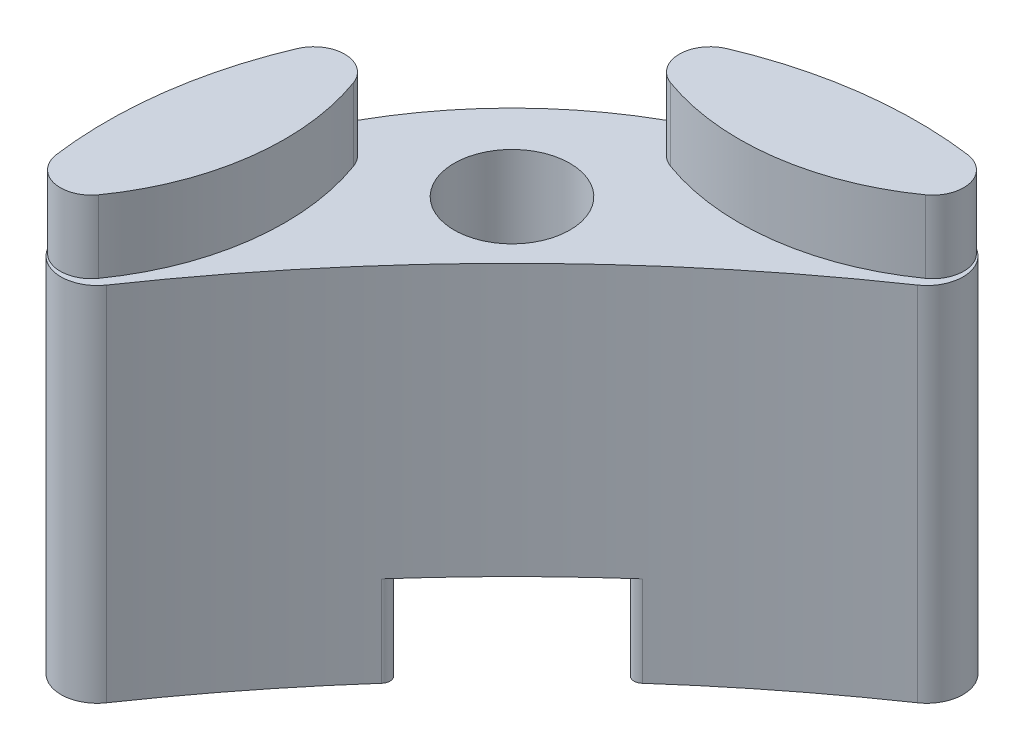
SolidWorks part; units mm, degrees
ref_plane "前视基准面" through (0, 0, 0) normal (0, 0, 1) x (1, 0, 0)
ref_plane "上视基准面" through (0, 0, 0) normal (0, 1, 0) x (1, 0, 0)
ref_plane "右视基准面" through (0, 0, 0) normal (1, 0, 0) x (0, 0, -1)
other "Configuration Table"
sketch "草图1" plane through (0, 0, 0) normal (0, 1, 0) x (1, 0, 0)
  line L0 (-32, 32) -> (32, 32) construction
  line L1 (-32, 32) -> (-32, -32) construction
  circle A0 centre (0, 0) radius 40 construction
  circle A3 centre (-32, 32) radius 1.6
  arc A4 (-34.7793, 30.8707) -> (-30.8707, 34.7793) centre (-32, 32) cw
  arc A5 (-30.8707, 34.7793) -> (-24.2826, 35.4874) centre (-28.2356, 41.2644) ccw
  arc A6 (-24.2826, 35.4874) -> (24.2826, 35.4874) centre (0, 0) cw
  arc A7 (-34.7793, 30.8707) -> (-35.4874, 24.2826) centre (-41.2644, 28.2356) cw
  arc A8 (30.8707, 34.7793) -> (34.7793, 30.8707) centre (32, 32) cw
  arc A9 (30.8707, 34.7793) -> (24.2826, 35.4874) centre (28.2356, 41.2644) cw
  arc A10 (34.7793, 30.8707) -> (35.4874, 24.2826) centre (41.2644, 28.2356) ccw
  arc A11 (35.4874, 24.2826) -> (35.4874, -24.2826) centre (0, 0) cw
  arc A12 (34.7793, -30.8707) -> (30.8707, -34.7793) centre (32, -32) cw
  arc A13 (34.7793, -30.8707) -> (35.4874, -24.2826) centre (41.2644, -28.2356) cw
  arc A14 (30.8707, -34.7793) -> (24.2826, -35.4874) centre (28.2356, -41.2644) ccw
  arc A15 (24.2826, -35.4874) -> (-24.2826, -35.4874) centre (0, 0) cw
  arc A16 (-30.8707, -34.7793) -> (-34.7793, -30.8707) centre (-32, -32) cw
  arc A17 (-30.8707, -34.7793) -> (-24.2826, -35.4874) centre (-28.2356, -41.2644) cw
  arc A18 (-34.7793, -30.8707) -> (-35.4874, -24.2826) centre (-41.2644, -28.2356) ccw
  arc A19 (-35.4874, -24.2826) -> (-35.4874, 24.2826) centre (0, 0) cw
  circle A20 centre (32, 32) radius 1.6
  circle A21 centre (32, -32) radius 1.6
  circle A22 centre (-32, -32) radius 1.6
  point P41 (0, 0)
  dimension "D2" = 80
  dimension "D3" = 4
  dimension "D4" = 3.2
  dimension "D7" = 43
  dimension "D8" = 7
  dimension "D9" = 3
  dimension "D5" = 32
  dimension "D6" = 32
  dimension "D12" = 90
  dimension "D13" = 64
  dimension "D14" = 64
  dimension "D10" = 2
  dimension "D11" = 2
extrude "凸台-拉伸1" add sketch "草图1" along normal blind 3
sketch "草图2" plane through (0, 0, 0) normal (0, -1, 0) x (1, 0, 0)
  circle A0 centre (-32, -32) radius 1.6
  arc A2 (-35.4874, -24.2826) -> (-24.2826, -35.4874) centre (0, 0) ccw
  arc A8 (-24.2826, -35.4874) -> (24.2826, -35.4874) centre (0, 0) ccw construction
  arc A9 (-24.2826, -35.4874) -> (-24.7148, -37.3039) centre (-24.8473, -36.3127) cw
  arc A10 (-24.7148, -37.3039) -> (-37.3039, -24.7148) centre (-26.1994, -26.1994) cw
  arc A11 (-37.3039, -24.7148) -> (-35.4874, -24.2826) centre (-36.3127, -24.8473) cw
  arc A12 (-34.7793, -30.8707) -> (-30.8707, -34.7793) centre (-32, -32) ccw construction
  dimension "D1" = 3.2
  dimension "D2" = 1
extrude "凸台-拉伸2" add sketch "草图2" along normal blind 10 from offset 10
sketch "草图3" plane through (0, -20, 0) normal (0, -1, 0) x (1, 0, 0)
  circle A0 centre (-32, -32) radius 3.05
  dimension "D1" = 6.1
extrude "切除-拉伸4" cut sketch "草图3" against normal blind 2.5
fillet "圆角1" radius 0.25 4 edges at (-31.7879, -18.75, -28.9574) (-28.9574, -18.75, -31.7879) (-34.5626, -18.75, -33.654) (-33.654, -18.75, -34.5626)
sketch "草图4" plane through (0, -10, 0) normal (0, 1, 0) x (1, 0, 0)
  line L0 (0, 0) -> (-32, 32) construction
  arc A0 (-34.9184, 30.5358) -> (-35.7567, 24.3333) centre (-41.2644, 28.2356) cw
  arc A2 (-35.4874, 24.2826) -> (-34.7793, 30.8707) centre (-41.2644, 28.2356) ccw construction
  arc A3 (-35.7567, 24.3333) -> (-37.3039, 24.7148) centre (-36.4553, 24.8283) cw
  arc A4 (-37.3039, 24.7148) -> (-36.5113, 30.5787) centre (-26.1994, 26.1994) cw
  arc A5 (-36.5113, 30.5787) -> (-34.9184, 30.5358) centre (-35.7233, 30.244) cw
  arc A6 (-24.7148, 37.3039) -> (-37.3039, 24.7148) centre (-26.1994, 26.1994) ccw construction
  arc A7 (-30.5787, 36.5113) -> (-30.5358, 34.9184) centre (-30.244, 35.7233) ccw
  arc A8 (-24.7148, 37.3039) -> (-30.5787, 36.5113) centre (-26.1994, 26.1994) ccw
  arc A9 (-24.3333, 35.7567) -> (-24.7148, 37.3039) centre (-24.8283, 36.4553) ccw
  arc A10 (-30.5358, 34.9184) -> (-24.3333, 35.7567) centre (-28.2356, 41.2644) ccw
  dimension "D1" = 6.75
extrude "凸台-拉伸3" add sketch "草图4" along normal blind 2
sketch "草图5" plane through (0, 3, 0) normal (0, 1, 0) x (1, 0, 0)
  circle A0 centre (0, 0) radius 50
  dimension "D1" = 100
extrude "切除-拉伸5" cut sketch "草图5" against normal blind 4
